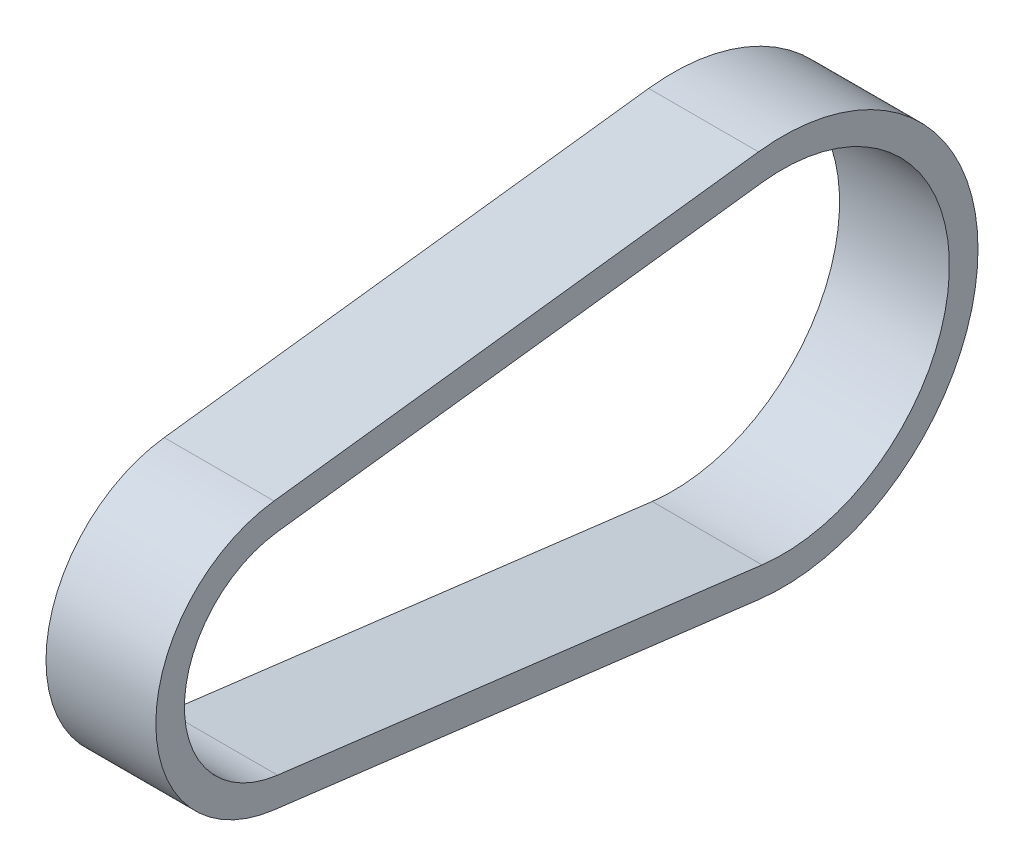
SolidWorks part; units mm, degrees
ref_plane "Plan de face" through (0, 0, 0) normal (0, 0, 1) x (1, 0, 0)
ref_plane "Plan de dessus" through (0, 0, 0) normal (0, 1, 0) x (1, 0, 0)
ref_plane "Plan de droite" through (0, 0, 0) normal (1, 0, 0) x (0, 0, -1)
sketch "Esquisse1" plane through (0, 0, 0) normal (1, 0, 0) x (0, 0, -1)
  line L0 (-30.0872, 0) -> (317.3434, 0) construction
  line L1 (0, -16.7788) -> (0, 145.6709) construction
  line L2 (258, 145.6709) -> (258, -16.7788) construction
  line L3 (-6.8649, 55.2804) -> (247.2168, 86.833)
  line L4 (-6.8649, -55.2804) -> (247.2168, -86.833)
  line L5 (-8.7134, 70.166) -> (245.3683, 101.7187)
  line L6 (-8.7134, -70.166) -> (245.3683, -101.7187)
  arc A0 (247.2168, -86.833) -> (247.2168, 86.833) centre (258, 0) ccw
  arc A1 (-6.8649, 55.2804) -> (-6.8649, -55.2804) centre (0, 0) ccw
  arc A4 (-8.7134, 70.166) -> (-8.7134, -70.166) centre (0, 0) ccw
  arc A5 (245.3683, -101.7187) -> (245.3683, 101.7187) centre (258, 0) ccw
  dimension "D1" = 258
extrude "Boss.-Extru.1" add sketch "Esquisse1" along normal blind 57.6
